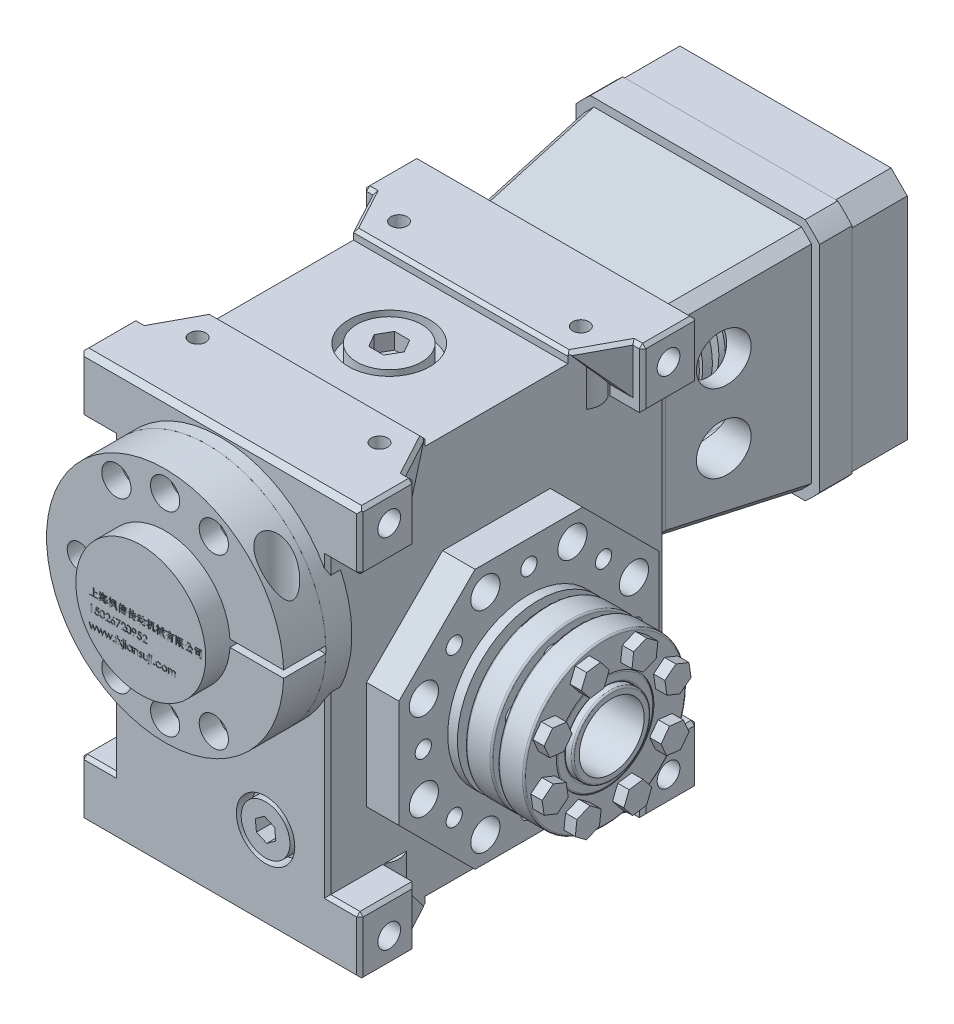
SolidWorks part; units mm, degrees
ref_plane "前视基准面" through (0, 0, 0) normal (0, 0, 1) x (1, 0, 0)
ref_plane "上视基准面" through (0, 0, 0) normal (0, 1, 0) x (1, 0, 0)
ref_plane "右视基准面" through (0, 0, 0) normal (1, 0, 0) x (0, 0, -1)
imported_body "JDLB035-CR箱体-1-solid1"
imported_body "JDLB035-CR箱体-1-solid2"
imported_body "JDLB035-ST75输入法兰-1-solid1"
imported_body "JDLB035-2C空心轴Φ20-1-solid1"
imported_body "ST75-50-70-M6伺服法兰接口-1-solid1"
imported_body "联轴器BD39-48-12-14锁紧-1-solid1"
imported_body "联轴器BD39-48-12-14锁紧-1-solid2"
imported_body "联轴器BD39-48-12-14锁紧-1-solid3"
imported_body "联轴器BD39-48-12-14锁紧-1-solid4"
imported_body "联轴器BD39-48-12-14锁紧-1-solid5"
imported_body "联轴器BD39-48-12-14锁紧-1-solid6"
imported_body "联轴器BD39-48-12-14锁紧-1-solid7"
imported_body "JDLB035-C1锁紧盘-24-50-18-1-solid1"
imported_body "JDLB035-C1锁紧盘-24-50-18-2-solid1"
sketch "草图1" plane through (34, 0, 0) normal (1, 0, 0) x (0, 0, -1)
  line L1 (-23.5836, 64.1802) -> (22.5405, 64.1802)
  line L2 (-23.5836, 64.1802) -> (-23.5836, 53.1444)
  line L3 (-23.5836, 53.1444) -> (22.5405, 53.1444)
  line L4 (22.5405, 64.1802) -> (22.5405, 53.1444)
  line L5 (-23.5836, 64.1802) -> (22.5405, 53.1444) construction
  line L6 (-23.5836, 53.1444) -> (22.5405, 64.1802) construction
  point P0 (-0.5216, 58.6623)
extrude "切除-拉伸2" cut sketch "草图1" against normal up to surface (1 mm away)
sketch "草图3" plane through (-34, 0, 0) normal (-1, 0, 0) x (0, 0, 1)
  line L1 (-24.0816, 63.6854) -> (19.7254, 63.6854)
  line L2 (-24.0816, 63.6854) -> (-24.0816, 52.8045)
  line L3 (-24.0816, 52.8045) -> (19.7254, 52.8045)
  line L4 (19.7254, 63.6854) -> (19.7254, 52.8045)
extrude "切除-拉伸3" cut sketch "草图3" against normal up to surface (1 mm away)
sketch "草图4" plane through (0, 0, 76.5) normal (0, 0, 1) x (1, 0, 0)
  text T0 "上海枫信传动机械有限公司  15026720952  www.fxjiansuji.com" font "Century Gothic" height in points 8
extrude "凸台-拉伸1" add sketch "草图4" along normal blind 0.1
